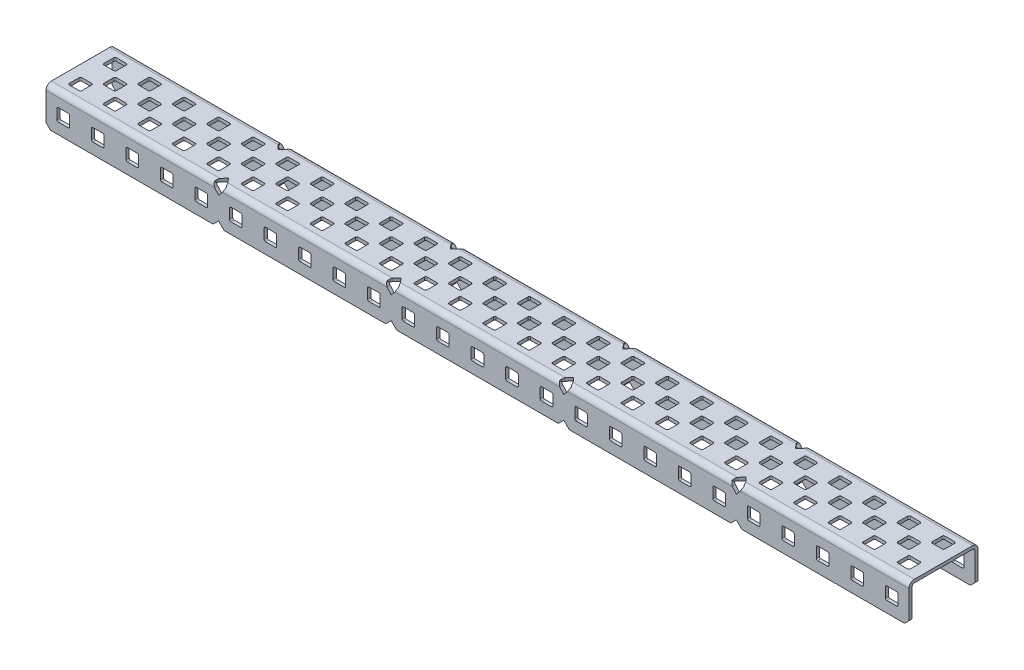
SolidWorks part; units mm, degrees
ref_plane "Front Plane" through (0, 0, 0) normal (0, 0, 1) x (1, 0, 0)
ref_plane "Top Plane" through (0, 0, 0) normal (0, 1, 0) x (1, 0, 0)
ref_plane "Right Plane" through (0, 0, 0) normal (1, 0, 0) x (0, 0, -1)
imported_body "Imported3"
sketch "Sketch1" plane through (0, 0, 8.631) normal (0, 0, -1) x (-1, 0, 0)
  line L0 (-39.0618, -12.7) -> (-35.0078, -12.7)
  line L1 (-35.0078, -12.7) -> (-37.0348, -10.673)
  line L2 (-37.0348, -10.673) -> (-39.0618, -12.7)
extrude "Cut-Extrude1" cut sketch "Sketch1" against normal through all
sketch "Sketch2" plane through (0, 0, 8.631) normal (0, 0, -1) x (-1, 0, 0)
  line L0 (-98.5078, -12.7) -> (-100.5348, -10.673)
  line L1 (-100.5348, -10.673) -> (-102.5618, -12.7)
  line L2 (-102.5618, -12.7) -> (-98.5078, -12.7)
extrude "Cut-Extrude2" cut sketch "Sketch2" against normal through all
sketch "Sketch3" plane through (0, 0, 8.631) normal (0, 0, -1) x (-1, 0, 0)
  line L0 (-166.0618, -12.7) -> (-162.0078, -12.7)
  line L1 (-162.0078, -12.7) -> (-164.0348, -10.673)
  line L2 (-164.0348, -10.673) -> (-166.0618, -12.7)
extrude "Cut-Extrude3" cut sketch "Sketch3" against normal through all
sketch "Sketch4" plane through (0, 0, 8.631) normal (0, 0, -1) x (-1, 0, 0)
  line L0 (-229.5618, -12.7) -> (-225.5078, -12.7)
  line L1 (-225.5078, -12.7) -> (-227.5348, -10.673)
  line L2 (-227.5348, -10.673) -> (-229.5618, -12.7)
extrude "Cut-Extrude4" cut sketch "Sketch4" against normal through all
sketch "Sketch5" plane through (0, 0, -14.4322) normal (0, 0, 1) x (1, 0, 0)
  line L0 (225.5078, -12.7) -> (229.5618, -12.7)
  line L1 (229.5618, -12.7) -> (227.5348, -10.673)
  line L2 (227.5348, -10.673) -> (225.5078, -12.7)
extrude "Cut-Extrude5" cut sketch "Sketch5" against normal through all
sketch "Sketch6" plane through (0, 0, -14.4322) normal (0, 0, 1) x (1, 0, 0)
  line L0 (162.0078, -12.7) -> (166.0618, -12.7)
  line L1 (166.0618, -12.7) -> (164.0348, -10.673)
  line L2 (164.0348, -10.673) -> (162.0078, -12.7)
extrude "Cut-Extrude6" cut sketch "Sketch6" against normal through all
sketch "Sketch7" plane through (0, 0, -14.4322) normal (0, 0, 1) x (1, 0, 0)
  line L0 (98.5078, -12.7) -> (102.5618, -12.7)
  line L1 (102.5618, -12.7) -> (100.5348, -10.673)
  line L2 (100.5348, -10.673) -> (98.5078, -12.7)
extrude "Cut-Extrude7" cut sketch "Sketch7" against normal through all
sketch "Sketch8" plane through (0, 0, -14.4322) normal (0, 0, 1) x (1, 0, 0)
  line L0 (35.0078, -12.7) -> (39.0618, -12.7)
  line L1 (39.0618, -12.7) -> (37.0348, -10.673)
  line L2 (37.0348, -10.673) -> (35.0078, -12.7)
extrude "Cut-Extrude8" cut sketch "Sketch8" against normal through all
sketch "Sketch9" plane through (0, 1.1684, 0) normal (0, 1, 0) x (-1, 0, 0)
  line L0 (-280.6462, -0.5892) -> (-280.6462, -5.212)
  line L1 (-280.6462, -5.212) -> (-276.0234, -5.212)
  line L2 (-276.0234, -5.212) -> (-276.0234, -0.5892)
  line L3 (-276.0234, -0.5892) -> (-280.6462, -0.5892)
extrude "Cut-Extrude9" cut sketch "Sketch9" against normal through all
sketch "Sketch10" plane through (0, 1.1684, 0) normal (0, 1, 0) x (-1, 0, 0)
  line L0 (-267.9462, -0.5892) -> (-267.9462, -5.212)
  line L1 (-267.9462, -5.212) -> (-263.3234, -5.212)
  line L2 (-263.3234, -5.212) -> (-263.3234, -0.5892)
  line L3 (-263.3234, -0.5892) -> (-267.9462, -0.5892)
extrude "Cut-Extrude10" cut sketch "Sketch10" against normal through all
sketch "Sketch11" plane through (0, 1.1684, 0) normal (0, 1, 0) x (-1, 0, 0)
  line L0 (-255.2462, -0.5892) -> (-255.2462, -5.212)
  line L1 (-255.2462, -5.212) -> (-250.6234, -5.212)
  line L2 (-250.6234, -5.212) -> (-250.6234, -0.5892)
  line L3 (-250.6234, -0.5892) -> (-255.2462, -0.5892)
extrude "Cut-Extrude11" cut sketch "Sketch11" against normal through all
sketch "Sketch12" plane through (0, 1.1684, 0) normal (0, 1, 0) x (-1, 0, 0)
  line L0 (-242.5462, -0.5892) -> (-242.5462, -5.212)
  line L1 (-242.5462, -5.212) -> (-237.9234, -5.212)
  line L2 (-237.9234, -5.212) -> (-237.9234, -0.5892)
  line L3 (-237.9234, -0.5892) -> (-242.5462, -0.5892)
extrude "Cut-Extrude12" cut sketch "Sketch12" against normal through all
sketch "Sketch13" plane through (0, 1.1684, 0) normal (0, 1, 0) x (-1, 0, 0)
  line L0 (-229.8462, -0.5892) -> (-229.8462, -5.212)
  line L1 (-229.8462, -5.212) -> (-225.2234, -5.212)
  line L2 (-225.2234, -5.212) -> (-225.2234, -0.5892)
  line L3 (-225.2234, -0.5892) -> (-229.8462, -0.5892)
extrude "Cut-Extrude13" cut sketch "Sketch13" against normal through all
sketch "Sketch14" plane through (0, 1.1684, 0) normal (0, 1, 0) x (-1, 0, 0)
  line L0 (-217.1462, -0.5892) -> (-217.1462, -5.212)
  line L1 (-217.1462, -5.212) -> (-212.5234, -5.212)
  line L2 (-212.5234, -5.212) -> (-212.5234, -0.5892)
  line L3 (-212.5234, -0.5892) -> (-217.1462, -0.5892)
extrude "Cut-Extrude14" cut sketch "Sketch14" against normal through all
sketch "Sketch15" plane through (0, 1.1684, 0) normal (0, 1, 0) x (-1, 0, 0)
  line L0 (-204.4462, -0.5892) -> (-204.4462, -5.212)
  line L1 (-204.4462, -5.212) -> (-199.8234, -5.212)
  line L2 (-199.8234, -5.212) -> (-199.8234, -0.5892)
  line L3 (-199.8234, -0.5892) -> (-204.4462, -0.5892)
extrude "Cut-Extrude15" cut sketch "Sketch15" against normal through all
sketch "Sketch16" plane through (0, 1.1684, 0) normal (0, 1, 0) x (-1, 0, 0)
  line L0 (-191.7462, -0.5892) -> (-191.7462, -5.212)
  line L1 (-191.7462, -5.212) -> (-187.1234, -5.212)
  line L2 (-187.1234, -5.212) -> (-187.1234, -0.5892)
  line L3 (-187.1234, -0.5892) -> (-191.7462, -0.5892)
extrude "Cut-Extrude16" cut sketch "Sketch16" against normal through all
sketch "Sketch17" plane through (0, 1.1684, 0) normal (0, 1, 0) x (-1, 0, 0)
  line L0 (-179.0462, -0.5892) -> (-179.0462, -5.212)
  line L1 (-179.0462, -5.212) -> (-174.4234, -5.212)
  line L2 (-174.4234, -5.212) -> (-174.4234, -0.5892)
  line L3 (-174.4234, -0.5892) -> (-179.0462, -0.5892)
extrude "Cut-Extrude17" cut sketch "Sketch17" against normal through all
sketch "Sketch18" plane through (0, 1.1684, 0) normal (0, 1, 0) x (-1, 0, 0)
  line L0 (-166.3462, -0.5892) -> (-166.3462, -5.212)
  line L1 (-166.3462, -5.212) -> (-161.7234, -5.212)
  line L2 (-161.7234, -5.212) -> (-161.7234, -0.5892)
  line L3 (-161.7234, -0.5892) -> (-166.3462, -0.5892)
extrude "Cut-Extrude18" cut sketch "Sketch18" against normal through all
sketch "Sketch19" plane through (0, 1.1684, 0) normal (0, 1, 0) x (-1, 0, 0)
  line L0 (-153.6462, -0.5892) -> (-153.6462, -5.212)
  line L1 (-153.6462, -5.212) -> (-149.0234, -5.212)
  line L2 (-149.0234, -5.212) -> (-149.0234, -0.5892)
  line L3 (-149.0234, -0.5892) -> (-153.6462, -0.5892)
extrude "Cut-Extrude19" cut sketch "Sketch19" against normal through all
sketch "Sketch20" plane through (0, 1.1684, 0) normal (0, 1, 0) x (-1, 0, 0)
  line L0 (-140.9462, -0.5892) -> (-140.9462, -5.212)
  line L1 (-140.9462, -5.212) -> (-136.3234, -5.212)
  line L2 (-136.3234, -5.212) -> (-136.3234, -0.5892)
  line L3 (-136.3234, -0.5892) -> (-140.9462, -0.5892)
extrude "Cut-Extrude20" cut sketch "Sketch20" against normal through all
sketch "Sketch21" plane through (0, 1.1684, 0) normal (0, 1, 0) x (-1, 0, 0)
  line L0 (-128.2462, -0.5892) -> (-128.2462, -5.212)
  line L1 (-128.2462, -5.212) -> (-123.6234, -5.212)
  line L2 (-123.6234, -5.212) -> (-123.6234, -0.5892)
  line L3 (-123.6234, -0.5892) -> (-128.2462, -0.5892)
extrude "Cut-Extrude21" cut sketch "Sketch21" against normal through all
sketch "Sketch22" plane through (0, 1.1684, 0) normal (0, 1, 0) x (-1, 0, 0)
  line L0 (-115.5462, -0.5892) -> (-115.5462, -5.212)
  line L1 (-115.5462, -5.212) -> (-110.9234, -5.212)
  line L2 (-110.9234, -5.212) -> (-110.9234, -0.5892)
  line L3 (-110.9234, -0.5892) -> (-115.5462, -0.5892)
extrude "Cut-Extrude22" cut sketch "Sketch22" against normal through all
sketch "Sketch23" plane through (0, 1.1684, 0) normal (0, 1, 0) x (-1, 0, 0)
  line L0 (-102.8462, -0.5892) -> (-102.8462, -5.212)
  line L1 (-102.8462, -5.212) -> (-98.2234, -5.212)
  line L2 (-98.2234, -5.212) -> (-98.2234, -0.5892)
  line L3 (-98.2234, -0.5892) -> (-102.8462, -0.5892)
extrude "Cut-Extrude23" cut sketch "Sketch23" against normal through all
sketch "Sketch24" plane through (0, 1.1684, 0) normal (0, 1, 0) x (-1, 0, 0)
  line L0 (-90.1462, -0.5892) -> (-90.1462, -5.212)
  line L1 (-90.1462, -5.212) -> (-85.5234, -5.212)
  line L2 (-85.5234, -5.212) -> (-85.5234, -0.5892)
  line L3 (-85.5234, -0.5892) -> (-90.1462, -0.5892)
extrude "Cut-Extrude24" cut sketch "Sketch24" against normal through all
sketch "Sketch25" plane through (0, 1.1684, 0) normal (0, 1, 0) x (-1, 0, 0)
  line L0 (-77.4462, -0.5892) -> (-77.4462, -5.212)
  line L1 (-77.4462, -5.212) -> (-72.8234, -5.212)
  line L2 (-72.8234, -5.212) -> (-72.8234, -0.5892)
  line L3 (-72.8234, -0.5892) -> (-77.4462, -0.5892)
extrude "Cut-Extrude25" cut sketch "Sketch25" against normal through all
sketch "Sketch26" plane through (0, 1.1684, 0) normal (0, 1, 0) x (-1, 0, 0)
  line L0 (-64.7462, -0.5892) -> (-64.7462, -5.212)
  line L1 (-64.7462, -5.212) -> (-60.1234, -5.212)
  line L2 (-60.1234, -5.212) -> (-60.1234, -0.5892)
  line L3 (-60.1234, -0.5892) -> (-64.7462, -0.5892)
extrude "Cut-Extrude26" cut sketch "Sketch26" against normal through all
sketch "Sketch27" plane through (0, 1.1684, 0) normal (0, 1, 0) x (-1, 0, 0)
  line L0 (-52.0462, -0.5892) -> (-52.0462, -5.212)
  line L1 (-52.0462, -5.212) -> (-47.4234, -5.212)
  line L2 (-47.4234, -5.212) -> (-47.4234, -0.5892)
  line L3 (-47.4234, -0.5892) -> (-52.0462, -0.5892)
extrude "Cut-Extrude27" cut sketch "Sketch27" against normal through all
sketch "Sketch28" plane through (0, 1.1684, 0) normal (0, 1, 0) x (-1, 0, 0)
  line L0 (-39.3462, -0.5892) -> (-39.3462, -5.212)
  line L1 (-39.3462, -5.212) -> (-34.7234, -5.212)
  line L2 (-34.7234, -5.212) -> (-34.7234, -0.5892)
  line L3 (-34.7234, -0.5892) -> (-39.3462, -0.5892)
extrude "Cut-Extrude28" cut sketch "Sketch28" against normal through all
sketch "Sketch29" plane through (0, 1.1684, 0) normal (0, 1, 0) x (-1, 0, 0)
  line L0 (-26.6462, -0.5892) -> (-26.6462, -5.212)
  line L1 (-26.6462, -5.212) -> (-22.0234, -5.212)
  line L2 (-22.0234, -5.212) -> (-22.0234, -0.5892)
  line L3 (-22.0234, -0.5892) -> (-26.6462, -0.5892)
extrude "Cut-Extrude29" cut sketch "Sketch29" against normal through all
sketch "Sketch30" plane through (0, 1.1684, 0) normal (0, 1, 0) x (-1, 0, 0)
  line L0 (-13.9462, -0.5892) -> (-13.9462, -5.212)
  line L1 (-13.9462, -5.212) -> (-9.3234, -5.212)
  line L2 (-9.3234, -5.212) -> (-9.3234, -0.5892)
  line L3 (-9.3234, -0.5892) -> (-13.9462, -0.5892)
extrude "Cut-Extrude30" cut sketch "Sketch30" against normal through all
sketch "Sketch31" plane through (0, 1.1684, 0) normal (0, 1, 0) x (-1, 0, 0)
  line L0 (17.8038, -6.9392) -> (17.8038, -11.562)
  line L1 (17.8038, -11.562) -> (22.4266, -11.562)
  line L2 (22.4266, -11.562) -> (22.4266, -6.9392)
  line L3 (22.4266, -6.9392) -> (17.8038, -6.9392)
extrude "Cut-Extrude31" cut sketch "Sketch31" against normal through all
sketch "Sketch32" plane through (0, 1.1684, 0) normal (0, 1, 0) x (-1, 0, 0)
  line L0 (17.8038, 5.7608) -> (17.8038, 1.138)
  line L1 (17.8038, 1.138) -> (22.4266, 1.138)
  line L2 (22.4266, 1.138) -> (22.4266, 5.7608)
  line L3 (22.4266, 5.7608) -> (17.8038, 5.7608)
extrude "Cut-Extrude32" cut sketch "Sketch32" against normal through all
sketch "Sketch33" plane through (0, 1.1684, 0) normal (0, 1, 0) x (-1, 0, 0)
  line L0 (11.4538, -0.5892) -> (11.4538, -5.212)
  line L1 (11.4538, -5.212) -> (16.0766, -5.212)
  line L2 (16.0766, -5.212) -> (16.0766, -0.5892)
  line L3 (16.0766, -0.5892) -> (11.4538, -0.5892)
extrude "Cut-Extrude33" cut sketch "Sketch33" against normal through all
sketch "Sketch34" plane through (0, 1.1684, 0) normal (0, 1, 0) x (-1, 0, 0)
  line L0 (5.1038, -6.9392) -> (5.1038, -11.562)
  line L1 (5.1038, -11.562) -> (9.7266, -11.562)
  line L2 (9.7266, -11.562) -> (9.7266, -6.9392)
  line L3 (9.7266, -6.9392) -> (5.1038, -6.9392)
extrude "Cut-Extrude34" cut sketch "Sketch34" against normal through all
sketch "Sketch35" plane through (0, 1.1684, 0) normal (0, 1, 0) x (-1, 0, 0)
  line L0 (5.1038, 5.7608) -> (5.1038, 1.138)
  line L1 (5.1038, 1.138) -> (9.7266, 1.138)
  line L2 (9.7266, 1.138) -> (9.7266, 5.7608)
  line L3 (9.7266, 5.7608) -> (5.1038, 5.7608)
extrude "Cut-Extrude35" cut sketch "Sketch35" against normal through all
sketch "Sketch36" plane through (0, 1.1684, 0) normal (0, 1, 0) x (-1, 0, 0)
  line L0 (-7.5962, -6.9392) -> (-7.5962, -11.562)
  line L1 (-7.5962, -11.562) -> (-2.9734, -11.562)
  line L2 (-2.9734, -11.562) -> (-2.9734, -6.9392)
  line L3 (-2.9734, -6.9392) -> (-7.5962, -6.9392)
extrude "Cut-Extrude36" cut sketch "Sketch36" against normal through all
sketch "Sketch37" plane through (0, 1.1684, 0) normal (0, 1, 0) x (-1, 0, 0)
  line L0 (-7.5962, 5.7608) -> (-7.5962, 1.138)
  line L1 (-7.5962, 1.138) -> (-2.9734, 1.138)
  line L2 (-2.9734, 1.138) -> (-2.9734, 5.7608)
  line L3 (-2.9734, 5.7608) -> (-7.5962, 5.7608)
extrude "Cut-Extrude37" cut sketch "Sketch37" against normal through all
sketch "Sketch38" plane through (0, 1.1684, 0) normal (0, 1, 0) x (-1, 0, 0)
  line L0 (-20.2962, -6.9392) -> (-20.2962, -11.562)
  line L1 (-20.2962, -11.562) -> (-15.6734, -11.562)
  line L2 (-15.6734, -11.562) -> (-15.6734, -6.9392)
  line L3 (-15.6734, -6.9392) -> (-20.2962, -6.9392)
extrude "Cut-Extrude38" cut sketch "Sketch38" against normal through all
sketch "Sketch39" plane through (0, 1.1684, 0) normal (0, 1, 0) x (-1, 0, 0)
  line L0 (-20.2962, 5.7608) -> (-20.2962, 1.138)
  line L1 (-20.2962, 1.138) -> (-15.6734, 1.138)
  line L2 (-15.6734, 1.138) -> (-15.6734, 5.7608)
  line L3 (-15.6734, 5.7608) -> (-20.2962, 5.7608)
extrude "Cut-Extrude39" cut sketch "Sketch39" against normal through all
sketch "Sketch40" plane through (0, 1.1684, 0) normal (0, 1, 0) x (-1, 0, 0)
  line L0 (-32.9962, -6.9392) -> (-32.9962, -11.562)
  line L1 (-32.9962, -11.562) -> (-28.3734, -11.562)
  line L2 (-28.3734, -11.562) -> (-28.3734, -6.9392)
  line L3 (-28.3734, -6.9392) -> (-32.9962, -6.9392)
extrude "Cut-Extrude40" cut sketch "Sketch40" against normal through all
sketch "Sketch41" plane through (0, 1.1684, 0) normal (0, 1, 0) x (-1, 0, 0)
  line L0 (-32.9962, 5.7608) -> (-32.9962, 1.138)
  line L1 (-32.9962, 1.138) -> (-28.3734, 1.138)
  line L2 (-28.3734, 1.138) -> (-28.3734, 5.7608)
  line L3 (-28.3734, 5.7608) -> (-32.9962, 5.7608)
extrude "Cut-Extrude41" cut sketch "Sketch41" against normal through all
sketch "Sketch42" plane through (0, 1.1684, 0) normal (0, 1, 0) x (-1, 0, 0)
  line L0 (-45.6962, -6.9392) -> (-45.6962, -11.562)
  line L1 (-45.6962, -11.562) -> (-41.0734, -11.562)
  line L2 (-41.0734, -11.562) -> (-41.0734, -6.9392)
  line L3 (-41.0734, -6.9392) -> (-45.6962, -6.9392)
extrude "Cut-Extrude42" cut sketch "Sketch42" against normal through all
sketch "Sketch43" plane through (0, 1.1684, 0) normal (0, 1, 0) x (-1, 0, 0)
  line L0 (-45.6962, 5.7608) -> (-45.6962, 1.138)
  line L1 (-45.6962, 1.138) -> (-41.0734, 1.138)
  line L2 (-41.0734, 1.138) -> (-41.0734, 5.7608)
  line L3 (-41.0734, 5.7608) -> (-45.6962, 5.7608)
extrude "Cut-Extrude43" cut sketch "Sketch43" against normal through all
sketch "Sketch44" plane through (0, 1.1684, 0) normal (0, 1, 0) x (-1, 0, 0)
  line L0 (-58.3962, -6.9392) -> (-58.3962, -11.562)
  line L1 (-58.3962, -11.562) -> (-53.7734, -11.562)
  line L2 (-53.7734, -11.562) -> (-53.7734, -6.9392)
  line L3 (-53.7734, -6.9392) -> (-58.3962, -6.9392)
extrude "Cut-Extrude44" cut sketch "Sketch44" against normal through all
sketch "Sketch45" plane through (0, 1.1684, 0) normal (0, 1, 0) x (-1, 0, 0)
  line L0 (-58.3962, 5.7608) -> (-58.3962, 1.138)
  line L1 (-58.3962, 1.138) -> (-53.7734, 1.138)
  line L2 (-53.7734, 1.138) -> (-53.7734, 5.7608)
  line L3 (-53.7734, 5.7608) -> (-58.3962, 5.7608)
extrude "Cut-Extrude45" cut sketch "Sketch45" against normal through all
sketch "Sketch46" plane through (0, 1.1684, 0) normal (0, 1, 0) x (-1, 0, 0)
  line L0 (-71.0962, -6.9392) -> (-71.0962, -11.562)
  line L1 (-71.0962, -11.562) -> (-66.4734, -11.562)
  line L2 (-66.4734, -11.562) -> (-66.4734, -6.9392)
  line L3 (-66.4734, -6.9392) -> (-71.0962, -6.9392)
extrude "Cut-Extrude46" cut sketch "Sketch46" against normal through all
sketch "Sketch47" plane through (0, 1.1684, 0) normal (0, 1, 0) x (-1, 0, 0)
  line L0 (-71.0962, 5.7608) -> (-71.0962, 1.138)
  line L1 (-71.0962, 1.138) -> (-66.4734, 1.138)
  line L2 (-66.4734, 1.138) -> (-66.4734, 5.7608)
  line L3 (-66.4734, 5.7608) -> (-71.0962, 5.7608)
extrude "Cut-Extrude47" cut sketch "Sketch47" against normal through all
sketch "Sketch48" plane through (0, 1.1684, 0) normal (0, 1, 0) x (-1, 0, 0)
  line L0 (-83.7962, -6.9392) -> (-83.7962, -11.562)
  line L1 (-83.7962, -11.562) -> (-79.1734, -11.562)
  line L2 (-79.1734, -11.562) -> (-79.1734, -6.9392)
  line L3 (-79.1734, -6.9392) -> (-83.7962, -6.9392)
extrude "Cut-Extrude48" cut sketch "Sketch48" against normal through all
sketch "Sketch49" plane through (0, 1.1684, 0) normal (0, 1, 0) x (-1, 0, 0)
  line L0 (-83.7962, 5.7608) -> (-83.7962, 1.138)
  line L1 (-83.7962, 1.138) -> (-79.1734, 1.138)
  line L2 (-79.1734, 1.138) -> (-79.1734, 5.7608)
  line L3 (-79.1734, 5.7608) -> (-83.7962, 5.7608)
extrude "Cut-Extrude49" cut sketch "Sketch49" against normal through all
sketch "Sketch50" plane through (0, 1.1684, 0) normal (0, 1, 0) x (-1, 0, 0)
  line L0 (-96.4962, -6.9392) -> (-96.4962, -11.562)
  line L1 (-96.4962, -11.562) -> (-91.8734, -11.562)
  line L2 (-91.8734, -11.562) -> (-91.8734, -6.9392)
  line L3 (-91.8734, -6.9392) -> (-96.4962, -6.9392)
extrude "Cut-Extrude50" cut sketch "Sketch50" against normal through all
sketch "Sketch51" plane through (0, 1.1684, 0) normal (0, 1, 0) x (-1, 0, 0)
  line L0 (-96.4962, 5.7608) -> (-96.4962, 1.138)
  line L1 (-96.4962, 1.138) -> (-91.8734, 1.138)
  line L2 (-91.8734, 1.138) -> (-91.8734, 5.7608)
  line L3 (-91.8734, 5.7608) -> (-96.4962, 5.7608)
extrude "Cut-Extrude51" cut sketch "Sketch51" against normal through all
sketch "Sketch52" plane through (0, 1.1684, 0) normal (0, 1, 0) x (-1, 0, 0)
  line L0 (-109.1962, -6.9392) -> (-109.1962, -11.562)
  line L1 (-109.1962, -11.562) -> (-104.5734, -11.562)
  line L2 (-104.5734, -11.562) -> (-104.5734, -6.9392)
  line L3 (-104.5734, -6.9392) -> (-109.1962, -6.9392)
extrude "Cut-Extrude52" cut sketch "Sketch52" against normal through all
sketch "Sketch53" plane through (0, 1.1684, 0) normal (0, 1, 0) x (-1, 0, 0)
  line L0 (-109.1962, 5.7608) -> (-109.1962, 1.138)
  line L1 (-109.1962, 1.138) -> (-104.5734, 1.138)
  line L2 (-104.5734, 1.138) -> (-104.5734, 5.7608)
  line L3 (-104.5734, 5.7608) -> (-109.1962, 5.7608)
extrude "Cut-Extrude53" cut sketch "Sketch53" against normal through all
sketch "Sketch54" plane through (0, 1.1684, 0) normal (0, 1, 0) x (-1, 0, 0)
  line L0 (-121.8962, -6.9392) -> (-121.8962, -11.562)
  line L1 (-121.8962, -11.562) -> (-117.2734, -11.562)
  line L2 (-117.2734, -11.562) -> (-117.2734, -6.9392)
  line L3 (-117.2734, -6.9392) -> (-121.8962, -6.9392)
extrude "Cut-Extrude54" cut sketch "Sketch54" against normal through all
sketch "Sketch55" plane through (0, 1.1684, 0) normal (0, 1, 0) x (-1, 0, 0)
  line L0 (-121.8962, 5.7608) -> (-121.8962, 1.138)
  line L1 (-121.8962, 1.138) -> (-117.2734, 1.138)
  line L2 (-117.2734, 1.138) -> (-117.2734, 5.7608)
  line L3 (-117.2734, 5.7608) -> (-121.8962, 5.7608)
extrude "Cut-Extrude55" cut sketch "Sketch55" against normal through all
sketch "Sketch56" plane through (0, 1.1684, 0) normal (0, 1, 0) x (-1, 0, 0)
  line L0 (-134.5962, -6.9392) -> (-134.5962, -11.562)
  line L1 (-134.5962, -11.562) -> (-129.9734, -11.562)
  line L2 (-129.9734, -11.562) -> (-129.9734, -6.9392)
  line L3 (-129.9734, -6.9392) -> (-134.5962, -6.9392)
extrude "Cut-Extrude56" cut sketch "Sketch56" against normal through all
sketch "Sketch57" plane through (0, 1.1684, 0) normal (0, 1, 0) x (-1, 0, 0)
  line L0 (-134.5962, 5.7608) -> (-134.5962, 1.138)
  line L1 (-134.5962, 1.138) -> (-129.9734, 1.138)
  line L2 (-129.9734, 1.138) -> (-129.9734, 5.7608)
  line L3 (-129.9734, 5.7608) -> (-134.5962, 5.7608)
extrude "Cut-Extrude57" cut sketch "Sketch57" against normal through all
sketch "Sketch58" plane through (0, 1.1684, 0) normal (0, 1, 0) x (-1, 0, 0)
  line L0 (-147.2962, -6.9392) -> (-147.2962, -11.562)
  line L1 (-147.2962, -11.562) -> (-142.6734, -11.562)
  line L2 (-142.6734, -11.562) -> (-142.6734, -6.9392)
  line L3 (-142.6734, -6.9392) -> (-147.2962, -6.9392)
extrude "Cut-Extrude58" cut sketch "Sketch58" against normal through all
sketch "Sketch59" plane through (0, 1.1684, 0) normal (0, 1, 0) x (-1, 0, 0)
  line L0 (-147.2962, 5.7608) -> (-147.2962, 1.138)
  line L1 (-147.2962, 1.138) -> (-142.6734, 1.138)
  line L2 (-142.6734, 1.138) -> (-142.6734, 5.7608)
  line L3 (-142.6734, 5.7608) -> (-147.2962, 5.7608)
extrude "Cut-Extrude59" cut sketch "Sketch59" against normal through all
sketch "Sketch60" plane through (0, 1.1684, 0) normal (0, 1, 0) x (-1, 0, 0)
  line L0 (-159.9962, -6.9392) -> (-159.9962, -11.562)
  line L1 (-159.9962, -11.562) -> (-155.3734, -11.562)
  line L2 (-155.3734, -11.562) -> (-155.3734, -6.9392)
  line L3 (-155.3734, -6.9392) -> (-159.9962, -6.9392)
extrude "Cut-Extrude60" cut sketch "Sketch60" against normal through all
sketch "Sketch61" plane through (0, 1.1684, 0) normal (0, 1, 0) x (-1, 0, 0)
  line L0 (-159.9962, 5.7608) -> (-159.9962, 1.138)
  line L1 (-159.9962, 1.138) -> (-155.3734, 1.138)
  line L2 (-155.3734, 1.138) -> (-155.3734, 5.7608)
  line L3 (-155.3734, 5.7608) -> (-159.9962, 5.7608)
extrude "Cut-Extrude61" cut sketch "Sketch61" against normal through all
sketch "Sketch62" plane through (0, 1.1684, 0) normal (0, 1, 0) x (-1, 0, 0)
  line L0 (-172.6962, -6.9392) -> (-172.6962, -11.562)
  line L1 (-172.6962, -11.562) -> (-168.0734, -11.562)
  line L2 (-168.0734, -11.562) -> (-168.0734, -6.9392)
  line L3 (-168.0734, -6.9392) -> (-172.6962, -6.9392)
extrude "Cut-Extrude62" cut sketch "Sketch62" against normal through all
sketch "Sketch63" plane through (0, 1.1684, 0) normal (0, 1, 0) x (-1, 0, 0)
  line L0 (-172.6962, 5.7608) -> (-172.6962, 1.138)
  line L1 (-172.6962, 1.138) -> (-168.0734, 1.138)
  line L2 (-168.0734, 1.138) -> (-168.0734, 5.7608)
  line L3 (-168.0734, 5.7608) -> (-172.6962, 5.7608)
extrude "Cut-Extrude63" cut sketch "Sketch63" against normal through all
sketch "Sketch64" plane through (0, 1.1684, 0) normal (0, 1, 0) x (-1, 0, 0)
  line L0 (-185.3962, -6.9392) -> (-185.3962, -11.562)
  line L1 (-185.3962, -11.562) -> (-180.7734, -11.562)
  line L2 (-180.7734, -11.562) -> (-180.7734, -6.9392)
  line L3 (-180.7734, -6.9392) -> (-185.3962, -6.9392)
extrude "Cut-Extrude64" cut sketch "Sketch64" against normal through all
sketch "Sketch65" plane through (0, 1.1684, 0) normal (0, 1, 0) x (-1, 0, 0)
  line L0 (-185.3962, 5.7608) -> (-185.3962, 1.138)
  line L1 (-185.3962, 1.138) -> (-180.7734, 1.138)
  line L2 (-180.7734, 1.138) -> (-180.7734, 5.7608)
  line L3 (-180.7734, 5.7608) -> (-185.3962, 5.7608)
extrude "Cut-Extrude65" cut sketch "Sketch65" against normal through all
sketch "Sketch66" plane through (0, 1.1684, 0) normal (0, 1, 0) x (-1, 0, 0)
  line L0 (-198.0962, -6.9392) -> (-198.0962, -11.562)
  line L1 (-198.0962, -11.562) -> (-193.4734, -11.562)
  line L2 (-193.4734, -11.562) -> (-193.4734, -6.9392)
  line L3 (-193.4734, -6.9392) -> (-198.0962, -6.9392)
extrude "Cut-Extrude66" cut sketch "Sketch66" against normal through all
sketch "Sketch67" plane through (0, 1.1684, 0) normal (0, 1, 0) x (-1, 0, 0)
  line L0 (-198.0962, 5.7608) -> (-198.0962, 1.138)
  line L1 (-198.0962, 1.138) -> (-193.4734, 1.138)
  line L2 (-193.4734, 1.138) -> (-193.4734, 5.7608)
  line L3 (-193.4734, 5.7608) -> (-198.0962, 5.7608)
extrude "Cut-Extrude67" cut sketch "Sketch67" against normal through all
sketch "Sketch68" plane through (0, 1.1684, 0) normal (0, 1, 0) x (-1, 0, 0)
  line L0 (-210.7962, -6.9392) -> (-210.7962, -11.562)
  line L1 (-210.7962, -11.562) -> (-206.1734, -11.562)
  line L2 (-206.1734, -11.562) -> (-206.1734, -6.9392)
  line L3 (-206.1734, -6.9392) -> (-210.7962, -6.9392)
extrude "Cut-Extrude68" cut sketch "Sketch68" against normal through all
sketch "Sketch69" plane through (0, 1.1684, 0) normal (0, 1, 0) x (-1, 0, 0)
  line L0 (-210.7962, 5.7608) -> (-210.7962, 1.138)
  line L1 (-210.7962, 1.138) -> (-206.1734, 1.138)
  line L2 (-206.1734, 1.138) -> (-206.1734, 5.7608)
  line L3 (-206.1734, 5.7608) -> (-210.7962, 5.7608)
extrude "Cut-Extrude69" cut sketch "Sketch69" against normal through all
sketch "Sketch70" plane through (0, 1.1684, 0) normal (0, 1, 0) x (-1, 0, 0)
  line L0 (-223.4962, -6.9392) -> (-223.4962, -11.562)
  line L1 (-223.4962, -11.562) -> (-218.8734, -11.562)
  line L2 (-218.8734, -11.562) -> (-218.8734, -6.9392)
  line L3 (-218.8734, -6.9392) -> (-223.4962, -6.9392)
extrude "Cut-Extrude70" cut sketch "Sketch70" against normal through all
sketch "Sketch71" plane through (0, 1.1684, 0) normal (0, 1, 0) x (-1, 0, 0)
  line L0 (-223.4962, 5.7608) -> (-223.4962, 1.138)
  line L1 (-223.4962, 1.138) -> (-218.8734, 1.138)
  line L2 (-218.8734, 1.138) -> (-218.8734, 5.7608)
  line L3 (-218.8734, 5.7608) -> (-223.4962, 5.7608)
extrude "Cut-Extrude71" cut sketch "Sketch71" against normal through all
sketch "Sketch72" plane through (0, 1.1684, 0) normal (0, 1, 0) x (-1, 0, 0)
  line L0 (-236.1962, -6.9392) -> (-236.1962, -11.562)
  line L1 (-236.1962, -11.562) -> (-231.5734, -11.562)
  line L2 (-231.5734, -11.562) -> (-231.5734, -6.9392)
  line L3 (-231.5734, -6.9392) -> (-236.1962, -6.9392)
extrude "Cut-Extrude72" cut sketch "Sketch72" against normal through all
sketch "Sketch73" plane through (0, 1.1684, 0) normal (0, 1, 0) x (-1, 0, 0)
  line L0 (-236.1962, 5.7608) -> (-236.1962, 1.138)
  line L1 (-236.1962, 1.138) -> (-231.5734, 1.138)
  line L2 (-231.5734, 1.138) -> (-231.5734, 5.7608)
  line L3 (-231.5734, 5.7608) -> (-236.1962, 5.7608)
extrude "Cut-Extrude73" cut sketch "Sketch73" against normal through all
sketch "Sketch74" plane through (0, 1.1684, 0) normal (0, 1, 0) x (-1, 0, 0)
  line L0 (-248.8962, -6.9392) -> (-248.8962, -11.562)
  line L1 (-248.8962, -11.562) -> (-244.2734, -11.562)
  line L2 (-244.2734, -11.562) -> (-244.2734, -6.9392)
  line L3 (-244.2734, -6.9392) -> (-248.8962, -6.9392)
extrude "Cut-Extrude74" cut sketch "Sketch74" against normal through all
sketch "Sketch75" plane through (0, 1.1684, 0) normal (0, 1, 0) x (-1, 0, 0)
  line L0 (-248.8962, 5.7608) -> (-248.8962, 1.138)
  line L1 (-248.8962, 1.138) -> (-244.2734, 1.138)
  line L2 (-244.2734, 1.138) -> (-244.2734, 5.7608)
  line L3 (-244.2734, 5.7608) -> (-248.8962, 5.7608)
extrude "Cut-Extrude75" cut sketch "Sketch75" against normal through all
sketch "Sketch76" plane through (0, 1.1684, 0) normal (0, 1, 0) x (-1, 0, 0)
  line L0 (-261.5962, -6.9392) -> (-261.5962, -11.562)
  line L1 (-261.5962, -11.562) -> (-256.9734, -11.562)
  line L2 (-256.9734, -11.562) -> (-256.9734, -6.9392)
  line L3 (-256.9734, -6.9392) -> (-261.5962, -6.9392)
extrude "Cut-Extrude76" cut sketch "Sketch76" against normal through all
sketch "Sketch77" plane through (0, 1.1684, 0) normal (0, 1, 0) x (-1, 0, 0)
  line L0 (-261.5962, 5.7608) -> (-261.5962, 1.138)
  line L1 (-261.5962, 1.138) -> (-256.9734, 1.138)
  line L2 (-256.9734, 1.138) -> (-256.9734, 5.7608)
  line L3 (-256.9734, 5.7608) -> (-261.5962, 5.7608)
extrude "Cut-Extrude77" cut sketch "Sketch77" against normal through all
sketch "Sketch78" plane through (0, 1.1684, 0) normal (0, 1, 0) x (-1, 0, 0)
  line L0 (-274.2962, -6.9392) -> (-274.2962, -11.562)
  line L1 (-274.2962, -11.562) -> (-269.6734, -11.562)
  line L2 (-269.6734, -11.562) -> (-269.6734, -6.9392)
  line L3 (-269.6734, -6.9392) -> (-274.2962, -6.9392)
extrude "Cut-Extrude78" cut sketch "Sketch78" against normal through all
sketch "Sketch79" plane through (0, 1.1684, 0) normal (0, 1, 0) x (-1, 0, 0)
  line L0 (-274.2962, 5.7608) -> (-274.2962, 1.138)
  line L1 (-274.2962, 1.138) -> (-269.6734, 1.138)
  line L2 (-269.6734, 1.138) -> (-269.6734, 5.7608)
  line L3 (-269.6734, 5.7608) -> (-274.2962, 5.7608)
extrude "Cut-Extrude79" cut sketch "Sketch79" against normal through all
sketch "Sketch80" plane through (0, 1.1684, 0) normal (0, 1, 0) x (-1, 0, 0)
  line L0 (-286.9962, -6.9392) -> (-286.9962, -11.562)
  line L1 (-286.9962, -11.562) -> (-282.3734, -11.562)
  line L2 (-282.3734, -11.562) -> (-282.3734, -6.9392)
  line L3 (-282.3734, -6.9392) -> (-286.9962, -6.9392)
extrude "Cut-Extrude80" cut sketch "Sketch80" against normal through all
sketch "Sketch81" plane through (0, 1.1684, 0) normal (0, 1, 0) x (-1, 0, 0)
  line L0 (-286.9962, 5.7608) -> (-286.9962, 1.138)
  line L1 (-286.9962, 1.138) -> (-282.3734, 1.138)
  line L2 (-282.3734, 1.138) -> (-282.3734, 5.7608)
  line L3 (-282.3734, 5.7608) -> (-286.9962, 5.7608)
extrude "Cut-Extrude81" cut sketch "Sketch81" against normal through all
sketch "Sketch82" plane through (0, 0, 8.631) normal (0, 0, -1) x (-1, 0, 0)
  line L0 (17.8038, -4.0386) -> (17.8038, -8.6614)
  line L1 (17.8038, -8.6614) -> (22.4266, -8.6614)
  line L2 (22.4266, -8.6614) -> (22.4266, -4.0386)
  line L3 (22.4266, -4.0386) -> (17.8038, -4.0386)
extrude "Cut-Extrude82" cut sketch "Sketch82" against normal through all
sketch "Sketch83" plane through (0, 0, 8.631) normal (0, 0, -1) x (-1, 0, 0)
  line L0 (5.1038, -4.0386) -> (5.1038, -8.6614)
  line L1 (5.1038, -8.6614) -> (9.7266, -8.6614)
  line L2 (9.7266, -8.6614) -> (9.7266, -4.0386)
  line L3 (9.7266, -4.0386) -> (5.1038, -4.0386)
extrude "Cut-Extrude83" cut sketch "Sketch83" against normal through all
sketch "Sketch84" plane through (0, 0, 8.631) normal (0, 0, -1) x (-1, 0, 0)
  line L0 (-7.5962, -4.0386) -> (-7.5962, -8.6614)
  line L1 (-7.5962, -8.6614) -> (-2.9734, -8.6614)
  line L2 (-2.9734, -8.6614) -> (-2.9734, -4.0386)
  line L3 (-2.9734, -4.0386) -> (-7.5962, -4.0386)
extrude "Cut-Extrude84" cut sketch "Sketch84" against normal through all
sketch "Sketch85" plane through (0, 0, 8.631) normal (0, 0, -1) x (-1, 0, 0)
  line L0 (-20.2962, -4.0386) -> (-20.2962, -8.6614)
  line L1 (-20.2962, -8.6614) -> (-15.6734, -8.6614)
  line L2 (-15.6734, -8.6614) -> (-15.6734, -4.0386)
  line L3 (-15.6734, -4.0386) -> (-20.2962, -4.0386)
extrude "Cut-Extrude85" cut sketch "Sketch85" against normal through all
sketch "Sketch86" plane through (0, 0, 8.631) normal (0, 0, -1) x (-1, 0, 0)
  line L0 (-32.9962, -4.0386) -> (-32.9962, -8.6614)
  line L1 (-32.9962, -8.6614) -> (-28.3734, -8.6614)
  line L2 (-28.3734, -8.6614) -> (-28.3734, -4.0386)
  line L3 (-28.3734, -4.0386) -> (-32.9962, -4.0386)
extrude "Cut-Extrude86" cut sketch "Sketch86" against normal through all
sketch "Sketch87" plane through (0, 0, 8.631) normal (0, 0, -1) x (-1, 0, 0)
  line L0 (-45.6962, -4.0386) -> (-45.6962, -8.6614)
  line L1 (-45.6962, -8.6614) -> (-41.0734, -8.6614)
  line L2 (-41.0734, -8.6614) -> (-41.0734, -4.0386)
  line L3 (-41.0734, -4.0386) -> (-45.6962, -4.0386)
extrude "Cut-Extrude87" cut sketch "Sketch87" against normal through all
sketch "Sketch88" plane through (0, 0, 8.631) normal (0, 0, -1) x (-1, 0, 0)
  line L0 (-58.3962, -4.0386) -> (-58.3962, -8.6614)
  line L1 (-58.3962, -8.6614) -> (-53.7734, -8.6614)
  line L2 (-53.7734, -8.6614) -> (-53.7734, -4.0386)
  line L3 (-53.7734, -4.0386) -> (-58.3962, -4.0386)
extrude "Cut-Extrude88" cut sketch "Sketch88" against normal through all
sketch "Sketch89" plane through (0, 0, 8.631) normal (0, 0, -1) x (-1, 0, 0)
  line L0 (-71.0962, -4.0386) -> (-71.0962, -8.6614)
  line L1 (-71.0962, -8.6614) -> (-66.4734, -8.6614)
  line L2 (-66.4734, -8.6614) -> (-66.4734, -4.0386)
  line L3 (-66.4734, -4.0386) -> (-71.0962, -4.0386)
extrude "Cut-Extrude89" cut sketch "Sketch89" against normal through all
sketch "Sketch90" plane through (0, 0, 8.631) normal (0, 0, -1) x (-1, 0, 0)
  line L0 (-83.7962, -4.0386) -> (-83.7962, -8.6614)
  line L1 (-83.7962, -8.6614) -> (-79.1734, -8.6614)
  line L2 (-79.1734, -8.6614) -> (-79.1734, -4.0386)
  line L3 (-79.1734, -4.0386) -> (-83.7962, -4.0386)
extrude "Cut-Extrude90" cut sketch "Sketch90" against normal through all
sketch "Sketch91" plane through (0, 0, 8.631) normal (0, 0, -1) x (-1, 0, 0)
  line L0 (-96.4962, -4.0386) -> (-96.4962, -8.6614)
  line L1 (-96.4962, -8.6614) -> (-91.8734, -8.6614)
  line L2 (-91.8734, -8.6614) -> (-91.8734, -4.0386)
  line L3 (-91.8734, -4.0386) -> (-96.4962, -4.0386)
extrude "Cut-Extrude91" cut sketch "Sketch91" against normal through all
sketch "Sketch92" plane through (0, 0, 8.631) normal (0, 0, -1) x (-1, 0, 0)
  line L0 (-109.1962, -4.0386) -> (-109.1962, -8.6614)
  line L1 (-109.1962, -8.6614) -> (-104.5734, -8.6614)
  line L2 (-104.5734, -8.6614) -> (-104.5734, -4.0386)
  line L3 (-104.5734, -4.0386) -> (-109.1962, -4.0386)
extrude "Cut-Extrude92" cut sketch "Sketch92" against normal through all
sketch "Sketch93" plane through (0, 0, 8.631) normal (0, 0, -1) x (-1, 0, 0)
  line L0 (-121.8962, -4.0386) -> (-121.8962, -8.6614)
  line L1 (-121.8962, -8.6614) -> (-117.2734, -8.6614)
  line L2 (-117.2734, -8.6614) -> (-117.2734, -4.0386)
  line L3 (-117.2734, -4.0386) -> (-121.8962, -4.0386)
extrude "Cut-Extrude93" cut sketch "Sketch93" against normal through all
sketch "Sketch94" plane through (0, 0, 8.631) normal (0, 0, -1) x (-1, 0, 0)
  line L0 (-134.5962, -4.0386) -> (-134.5962, -8.6614)
  line L1 (-134.5962, -8.6614) -> (-129.9734, -8.6614)
  line L2 (-129.9734, -8.6614) -> (-129.9734, -4.0386)
  line L3 (-129.9734, -4.0386) -> (-134.5962, -4.0386)
extrude "Cut-Extrude94" cut sketch "Sketch94" against normal through all
sketch "Sketch95" plane through (0, 0, 8.631) normal (0, 0, -1) x (-1, 0, 0)
  line L0 (-147.2962, -4.0386) -> (-147.2962, -8.6614)
  line L1 (-147.2962, -8.6614) -> (-142.6734, -8.6614)
  line L2 (-142.6734, -8.6614) -> (-142.6734, -4.0386)
  line L3 (-142.6734, -4.0386) -> (-147.2962, -4.0386)
extrude "Cut-Extrude95" cut sketch "Sketch95" against normal through all
sketch "Sketch96" plane through (0, 0, 8.631) normal (0, 0, -1) x (-1, 0, 0)
  line L0 (-159.9962, -4.0386) -> (-159.9962, -8.6614)
  line L1 (-159.9962, -8.6614) -> (-155.3734, -8.6614)
  line L2 (-155.3734, -8.6614) -> (-155.3734, -4.0386)
  line L3 (-155.3734, -4.0386) -> (-159.9962, -4.0386)
extrude "Cut-Extrude96" cut sketch "Sketch96" against normal through all
sketch "Sketch97" plane through (0, 0, 8.631) normal (0, 0, -1) x (-1, 0, 0)
  line L0 (-172.6962, -4.0386) -> (-172.6962, -8.6614)
  line L1 (-172.6962, -8.6614) -> (-168.0734, -8.6614)
  line L2 (-168.0734, -8.6614) -> (-168.0734, -4.0386)
  line L3 (-168.0734, -4.0386) -> (-172.6962, -4.0386)
extrude "Cut-Extrude97" cut sketch "Sketch97" against normal through all
sketch "Sketch98" plane through (0, 0, 8.631) normal (0, 0, -1) x (-1, 0, 0)
  line L0 (-185.3962, -4.0386) -> (-185.3962, -8.6614)
  line L1 (-185.3962, -8.6614) -> (-180.7734, -8.6614)
  line L2 (-180.7734, -8.6614) -> (-180.7734, -4.0386)
  line L3 (-180.7734, -4.0386) -> (-185.3962, -4.0386)
extrude "Cut-Extrude98" cut sketch "Sketch98" against normal through all
sketch "Sketch99" plane through (0, 0, 8.631) normal (0, 0, -1) x (-1, 0, 0)
  line L0 (-198.0962, -4.0386) -> (-198.0962, -8.6614)
  line L1 (-198.0962, -8.6614) -> (-193.4734, -8.6614)
  line L2 (-193.4734, -8.6614) -> (-193.4734, -4.0386)
  line L3 (-193.4734, -4.0386) -> (-198.0962, -4.0386)
extrude "Cut-Extrude99" cut sketch "Sketch99" against normal through all
sketch "Sketch100" plane through (0, 0, 8.631) normal (0, 0, -1) x (-1, 0, 0)
  line L0 (-210.7962, -4.0386) -> (-210.7962, -8.6614)
  line L1 (-210.7962, -8.6614) -> (-206.1734, -8.6614)
  line L2 (-206.1734, -8.6614) -> (-206.1734, -4.0386)
  line L3 (-206.1734, -4.0386) -> (-210.7962, -4.0386)
extrude "Cut-Extrude100" cut sketch "Sketch100" against normal through all
sketch "Sketch101" plane through (0, 0, 8.631) normal (0, 0, -1) x (-1, 0, 0)
  line L0 (-223.4962, -4.0386) -> (-223.4962, -8.6614)
  line L1 (-223.4962, -8.6614) -> (-218.8734, -8.6614)
  line L2 (-218.8734, -8.6614) -> (-218.8734, -4.0386)
  line L3 (-218.8734, -4.0386) -> (-223.4962, -4.0386)
extrude "Cut-Extrude101" cut sketch "Sketch101" against normal through all
sketch "Sketch102" plane through (0, 0, 8.631) normal (0, 0, -1) x (-1, 0, 0)
  line L0 (-236.1962, -4.0386) -> (-236.1962, -8.6614)
  line L1 (-236.1962, -8.6614) -> (-231.5734, -8.6614)
  line L2 (-231.5734, -8.6614) -> (-231.5734, -4.0386)
  line L3 (-231.5734, -4.0386) -> (-236.1962, -4.0386)
extrude "Cut-Extrude102" cut sketch "Sketch102" against normal through all
sketch "Sketch103" plane through (0, 0, 8.631) normal (0, 0, -1) x (-1, 0, 0)
  line L0 (-248.8962, -4.0386) -> (-248.8962, -8.6614)
  line L1 (-248.8962, -8.6614) -> (-244.2734, -8.6614)
  line L2 (-244.2734, -8.6614) -> (-244.2734, -4.0386)
  line L3 (-244.2734, -4.0386) -> (-248.8962, -4.0386)
extrude "Cut-Extrude103" cut sketch "Sketch103" against normal through all
sketch "Sketch104" plane through (0, 0, 8.631) normal (0, 0, -1) x (-1, 0, 0)
  line L0 (-261.5962, -4.0386) -> (-261.5962, -8.6614)
  line L1 (-261.5962, -8.6614) -> (-256.9734, -8.6614)
  line L2 (-256.9734, -8.6614) -> (-256.9734, -4.0386)
  line L3 (-256.9734, -4.0386) -> (-261.5962, -4.0386)
extrude "Cut-Extrude104" cut sketch "Sketch104" against normal through all
sketch "Sketch105" plane through (0, 0, 8.631) normal (0, 0, -1) x (-1, 0, 0)
  line L0 (-274.2962, -4.0386) -> (-274.2962, -8.6614)
  line L1 (-274.2962, -8.6614) -> (-269.6734, -8.6614)
  line L2 (-269.6734, -8.6614) -> (-269.6734, -4.0386)
  line L3 (-269.6734, -4.0386) -> (-274.2962, -4.0386)
extrude "Cut-Extrude105" cut sketch "Sketch105" against normal through all
sketch "Sketch106" plane through (0, 0, 8.631) normal (0, 0, -1) x (-1, 0, 0)
  line L0 (-286.9962, -4.0386) -> (-286.9962, -8.6614)
  line L1 (-286.9962, -8.6614) -> (-282.3734, -8.6614)
  line L2 (-282.3734, -8.6614) -> (-282.3734, -4.0386)
  line L3 (-282.3734, -4.0386) -> (-286.9962, -4.0386)
extrude "Cut-Extrude106" cut sketch "Sketch106" against normal through all
sketch "Sketch107" plane through (0, 0, -14.4322) normal (0, 0, 1) x (1, 0, 0)
  line L0 (-17.8038, -8.6614) -> (-17.8038, -4.0386)
  line L1 (-17.8038, -4.0386) -> (-22.4266, -4.0386)
  line L2 (-22.4266, -4.0386) -> (-22.4266, -8.6614)
  line L3 (-22.4266, -8.6614) -> (-17.8038, -8.6614)
extrude "Cut-Extrude107" cut sketch "Sketch107" against normal through all
sketch "Sketch108" plane through (0, 0, -14.4322) normal (0, 0, 1) x (1, 0, 0)
  line L0 (-5.1038, -8.6614) -> (-5.1038, -4.0386)
  line L1 (-5.1038, -4.0386) -> (-9.7266, -4.0386)
  line L2 (-9.7266, -4.0386) -> (-9.7266, -8.6614)
  line L3 (-9.7266, -8.6614) -> (-5.1038, -8.6614)
extrude "Cut-Extrude108" cut sketch "Sketch108" against normal through all
sketch "Sketch109" plane through (0, 0, -14.4322) normal (0, 0, 1) x (1, 0, 0)
  line L0 (7.5962, -8.6614) -> (7.5962, -4.0386)
  line L1 (7.5962, -4.0386) -> (2.9734, -4.0386)
  line L2 (2.9734, -4.0386) -> (2.9734, -8.6614)
  line L3 (2.9734, -8.6614) -> (7.5962, -8.6614)
extrude "Cut-Extrude109" cut sketch "Sketch109" against normal through all
sketch "Sketch110" plane through (0, 0, -14.4322) normal (0, 0, 1) x (1, 0, 0)
  line L0 (20.2962, -8.6614) -> (20.2962, -4.0386)
  line L1 (20.2962, -4.0386) -> (15.6734, -4.0386)
  line L2 (15.6734, -4.0386) -> (15.6734, -8.6614)
  line L3 (15.6734, -8.6614) -> (20.2962, -8.6614)
extrude "Cut-Extrude110" cut sketch "Sketch110" against normal through all
sketch "Sketch111" plane through (0, 0, -14.4322) normal (0, 0, 1) x (1, 0, 0)
  line L0 (32.9962, -8.6614) -> (32.9962, -4.0386)
  line L1 (32.9962, -4.0386) -> (28.3734, -4.0386)
  line L2 (28.3734, -4.0386) -> (28.3734, -8.6614)
  line L3 (28.3734, -8.6614) -> (32.9962, -8.6614)
extrude "Cut-Extrude111" cut sketch "Sketch111" against normal through all
sketch "Sketch112" plane through (0, 0, -14.4322) normal (0, 0, 1) x (1, 0, 0)
  line L0 (45.6962, -8.6614) -> (45.6962, -4.0386)
  line L1 (45.6962, -4.0386) -> (41.0734, -4.0386)
  line L2 (41.0734, -4.0386) -> (41.0734, -8.6614)
  line L3 (41.0734, -8.6614) -> (45.6962, -8.6614)
extrude "Cut-Extrude112" cut sketch "Sketch112" against normal through all
sketch "Sketch113" plane through (0, 0, -14.4322) normal (0, 0, 1) x (1, 0, 0)
  line L0 (58.3962, -8.6614) -> (58.3962, -4.0386)
  line L1 (58.3962, -4.0386) -> (53.7734, -4.0386)
  line L2 (53.7734, -4.0386) -> (53.7734, -8.6614)
  line L3 (53.7734, -8.6614) -> (58.3962, -8.6614)
extrude "Cut-Extrude113" cut sketch "Sketch113" against normal through all
sketch "Sketch114" plane through (0, 0, -14.4322) normal (0, 0, 1) x (1, 0, 0)
  line L0 (71.0962, -8.6614) -> (71.0962, -4.0386)
  line L1 (71.0962, -4.0386) -> (66.4734, -4.0386)
  line L2 (66.4734, -4.0386) -> (66.4734, -8.6614)
  line L3 (66.4734, -8.6614) -> (71.0962, -8.6614)
extrude "Cut-Extrude114" cut sketch "Sketch114" against normal through all
sketch "Sketch115" plane through (0, 0, -14.4322) normal (0, 0, 1) x (1, 0, 0)
  line L0 (83.7962, -8.6614) -> (83.7962, -4.0386)
  line L1 (83.7962, -4.0386) -> (79.1734, -4.0386)
  line L2 (79.1734, -4.0386) -> (79.1734, -8.6614)
  line L3 (79.1734, -8.6614) -> (83.7962, -8.6614)
extrude "Cut-Extrude115" cut sketch "Sketch115" against normal through all
sketch "Sketch116" plane through (0, 0, -14.4322) normal (0, 0, 1) x (1, 0, 0)
  line L0 (96.4962, -8.6614) -> (96.4962, -4.0386)
  line L1 (96.4962, -4.0386) -> (91.8734, -4.0386)
  line L2 (91.8734, -4.0386) -> (91.8734, -8.6614)
  line L3 (91.8734, -8.6614) -> (96.4962, -8.6614)
extrude "Cut-Extrude116" cut sketch "Sketch116" against normal through all
sketch "Sketch117" plane through (0, 0, -14.4322) normal (0, 0, 1) x (1, 0, 0)
  line L0 (109.1962, -8.6614) -> (109.1962, -4.0386)
  line L1 (109.1962, -4.0386) -> (104.5734, -4.0386)
  line L2 (104.5734, -4.0386) -> (104.5734, -8.6614)
  line L3 (104.5734, -8.6614) -> (109.1962, -8.6614)
extrude "Cut-Extrude117" cut sketch "Sketch117" against normal through all
sketch "Sketch118" plane through (0, 0, -14.4322) normal (0, 0, 1) x (1, 0, 0)
  line L0 (121.8962, -8.6614) -> (121.8962, -4.0386)
  line L1 (121.8962, -4.0386) -> (117.2734, -4.0386)
  line L2 (117.2734, -4.0386) -> (117.2734, -8.6614)
  line L3 (117.2734, -8.6614) -> (121.8962, -8.6614)
extrude "Cut-Extrude118" cut sketch "Sketch118" against normal through all
sketch "Sketch119" plane through (0, 0, -14.4322) normal (0, 0, 1) x (1, 0, 0)
  line L0 (134.5962, -8.6614) -> (134.5962, -4.0386)
  line L1 (134.5962, -4.0386) -> (129.9734, -4.0386)
  line L2 (129.9734, -4.0386) -> (129.9734, -8.6614)
  line L3 (129.9734, -8.6614) -> (134.5962, -8.6614)
extrude "Cut-Extrude119" cut sketch "Sketch119" against normal through all
sketch "Sketch120" plane through (0, 0, -14.4322) normal (0, 0, 1) x (1, 0, 0)
  line L0 (147.2962, -8.6614) -> (147.2962, -4.0386)
  line L1 (147.2962, -4.0386) -> (142.6734, -4.0386)
  line L2 (142.6734, -4.0386) -> (142.6734, -8.6614)
  line L3 (142.6734, -8.6614) -> (147.2962, -8.6614)
extrude "Cut-Extrude120" cut sketch "Sketch120" against normal through all
sketch "Sketch121" plane through (0, 0, -14.4322) normal (0, 0, 1) x (1, 0, 0)
  line L0 (159.9962, -8.6614) -> (159.9962, -4.0386)
  line L1 (159.9962, -4.0386) -> (155.3734, -4.0386)
  line L2 (155.3734, -4.0386) -> (155.3734, -8.6614)
  line L3 (155.3734, -8.6614) -> (159.9962, -8.6614)
extrude "Cut-Extrude121" cut sketch "Sketch121" against normal through all
sketch "Sketch122" plane through (0, 0, -14.4322) normal (0, 0, 1) x (1, 0, 0)
  line L0 (172.6962, -8.6614) -> (172.6962, -4.0386)
  line L1 (172.6962, -4.0386) -> (168.0734, -4.0386)
  line L2 (168.0734, -4.0386) -> (168.0734, -8.6614)
  line L3 (168.0734, -8.6614) -> (172.6962, -8.6614)
extrude "Cut-Extrude122" cut sketch "Sketch122" against normal through all
sketch "Sketch123" plane through (0, 0, -14.4322) normal (0, 0, 1) x (1, 0, 0)
  line L0 (185.3962, -8.6614) -> (185.3962, -4.0386)
  line L1 (185.3962, -4.0386) -> (180.7734, -4.0386)
  line L2 (180.7734, -4.0386) -> (180.7734, -8.6614)
  line L3 (180.7734, -8.6614) -> (185.3962, -8.6614)
extrude "Cut-Extrude123" cut sketch "Sketch123" against normal through all
sketch "Sketch124" plane through (0, 0, -14.4322) normal (0, 0, 1) x (1, 0, 0)
  line L0 (198.0962, -8.6614) -> (198.0962, -4.0386)
  line L1 (198.0962, -4.0386) -> (193.4734, -4.0386)
  line L2 (193.4734, -4.0386) -> (193.4734, -8.6614)
  line L3 (193.4734, -8.6614) -> (198.0962, -8.6614)
extrude "Cut-Extrude124" cut sketch "Sketch124" against normal through all
sketch "Sketch125" plane through (0, 0, -14.4322) normal (0, 0, 1) x (1, 0, 0)
  line L0 (210.7962, -8.6614) -> (210.7962, -4.0386)
  line L1 (210.7962, -4.0386) -> (206.1734, -4.0386)
  line L2 (206.1734, -4.0386) -> (206.1734, -8.6614)
  line L3 (206.1734, -8.6614) -> (210.7962, -8.6614)
extrude "Cut-Extrude125" cut sketch "Sketch125" against normal through all
sketch "Sketch126" plane through (0, 0, -14.4322) normal (0, 0, 1) x (1, 0, 0)
  line L0 (223.4962, -8.6614) -> (223.4962, -4.0386)
  line L1 (223.4962, -4.0386) -> (218.8734, -4.0386)
  line L2 (218.8734, -4.0386) -> (218.8734, -8.6614)
  line L3 (218.8734, -8.6614) -> (223.4962, -8.6614)
extrude "Cut-Extrude126" cut sketch "Sketch126" against normal through all
sketch "Sketch127" plane through (0, 0, -14.4322) normal (0, 0, 1) x (1, 0, 0)
  line L0 (236.1962, -8.6614) -> (236.1962, -4.0386)
  line L1 (236.1962, -4.0386) -> (231.5734, -4.0386)
  line L2 (231.5734, -4.0386) -> (231.5734, -8.6614)
  line L3 (231.5734, -8.6614) -> (236.1962, -8.6614)
extrude "Cut-Extrude127" cut sketch "Sketch127" against normal through all
sketch "Sketch128" plane through (0, 0, -14.4322) normal (0, 0, 1) x (1, 0, 0)
  line L0 (248.8962, -8.6614) -> (248.8962, -4.0386)
  line L1 (248.8962, -4.0386) -> (244.2734, -4.0386)
  line L2 (244.2734, -4.0386) -> (244.2734, -8.6614)
  line L3 (244.2734, -8.6614) -> (248.8962, -8.6614)
extrude "Cut-Extrude128" cut sketch "Sketch128" against normal through all
sketch "Sketch129" plane through (0, 0, -14.4322) normal (0, 0, 1) x (1, 0, 0)
  line L0 (261.5962, -8.6614) -> (261.5962, -4.0386)
  line L1 (261.5962, -4.0386) -> (256.9734, -4.0386)
  line L2 (256.9734, -4.0386) -> (256.9734, -8.6614)
  line L3 (256.9734, -8.6614) -> (261.5962, -8.6614)
extrude "Cut-Extrude129" cut sketch "Sketch129" against normal through all
sketch "Sketch130" plane through (0, 0, -14.4322) normal (0, 0, 1) x (1, 0, 0)
  line L0 (274.2962, -8.6614) -> (274.2962, -4.0386)
  line L1 (274.2962, -4.0386) -> (269.6734, -4.0386)
  line L2 (269.6734, -4.0386) -> (269.6734, -8.6614)
  line L3 (269.6734, -8.6614) -> (274.2962, -8.6614)
extrude "Cut-Extrude130" cut sketch "Sketch130" against normal through all
sketch "Sketch131" plane through (0, 0, -14.4322) normal (0, 0, 1) x (1, 0, 0)
  line L0 (286.9962, -8.6614) -> (286.9962, -4.0386)
  line L1 (286.9962, -4.0386) -> (282.3734, -4.0386)
  line L2 (282.3734, -4.0386) -> (282.3734, -8.6614)
  line L3 (282.3734, -8.6614) -> (286.9962, -8.6614)
extrude "Cut-Extrude131" cut sketch "Sketch131" against normal through all
sketch "Sketch132" plane through (0, 0, 0) normal (0, -1, 0) x (1, 0, 0)
  line L0 (-3.3766, -5.212) -> (1.2462, -5.212)
  line L1 (1.2462, -5.212) -> (1.2462, -0.5892)
  line L2 (1.2462, -0.5892) -> (-3.3766, -0.5892)
  line L3 (-3.3766, -0.5892) -> (-3.3766, -5.212)
extrude "Cut-Extrude132" cut sketch "Sketch132" against normal through all
chamfer "Chamfer1" distance 1.6256 angle 45
fillet "Fillet1" radius 0.508
fillet "Fillet2" radius 0.8128
fillet "Fillet3" radius 1.9812
